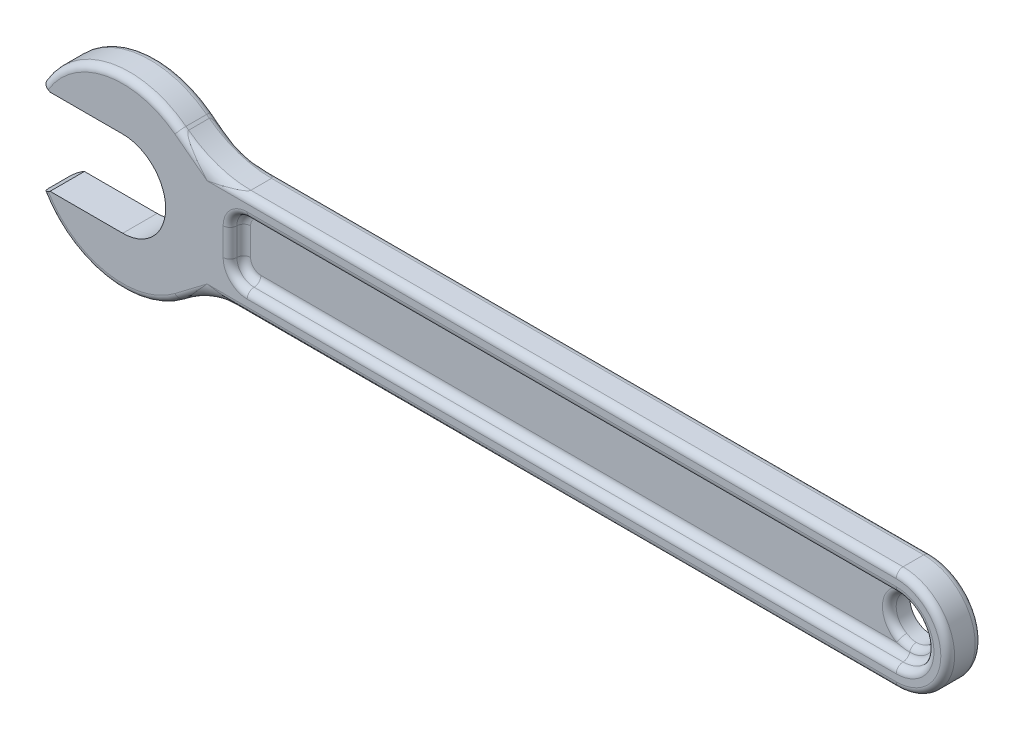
SolidWorks part; units mm, degrees
ref_plane "Front" through (0, 0, 0) normal (0, 0, 1) x (1, 0, 0)
ref_plane "Top" through (0, 0, 0) normal (0, 1, 0) x (1, 0, 0)
ref_plane "Right" through (0, 0, 0) normal (1, 0, 0) x (0, 0, -1)
sketch "Sketch1" plane through (0, 0, 0) normal (0, 0, 1) x (1, 0, 0)
  line L1 (-15.4891, 23.1705) -> (184.5109, 23.1705)
  line L2 (-15.4891, 23.1705) -> (-15.4891, -6.8295)
  line L3 (-15.4891, -6.8295) -> (184.5109, -6.8295)
  arc A0 (184.5109, -6.8295) -> (184.5109, 23.1705) centre (184.5109, 8.1705) ccw
  dimension "D1" = 30
  dimension "D2" = 200
extrude "Extrude1" add sketch "Sketch1" along normal blind 10
shell "Shell1" thickness 6
sketch "Sketch3" plane through (0, 0, 0) normal (0, 0, 1) x (1, 0, 0)
  line L0 (-15.4891, 23.1705) -> (-24.3001, 29.8482)
  line L1 (-15.4891, -6.8295) -> (-24.3001, -13.5072)
  line L2 (-15.4891, 23.1705) -> (-15.4891, -6.8295) construction
  line L3 (-15.4891, 23.1705) -> (-15.4891, -6.8295)
  arc A0 (-24.3001, 29.8482) -> (-24.3001, -13.5072) centre (-40.7293, 8.1705) ccw
  dimension "D1" = 54.4
extrude "Extrude2" add sketch "Sketch3" along normal through all
sketch "Sketch4" plane through (0, 0, 10) normal (0, 0, 1) x (1, 0, 0)
  line L0 (-40.7293, 20.6705) -> (-64.8869, 20.6705)
  line L1 (-40.7293, -4.3295) -> (-64.8869, -4.3295)
  arc A0 (-40.7293, -4.3295) -> (-40.7293, 20.6705) centre (-40.7293, 8.1705) ccw
  arc A1 (-24.3001, 29.8482) -> (-24.3001, -13.5072) centre (-40.7293, 8.1705) ccw construction
  arc A2 (-64.8869, 20.6705) -> (-64.8869, -4.3295) centre (-40.7293, 8.1705) ccw
  dimension "D1" = 25
extrude "Cut-Extrude1" cut sketch "Sketch4" against normal through all
sketch "Sketch5" plane through (0, 0, 6) normal (0, 0, 1) x (1, 0, 0)
  circle A0 centre (184.5109, 8.1705) radius 6
  dimension "D1" = 12
extrude "Cut-Extrude2" cut sketch "Sketch5" against normal through all
fillet "Fillet3" radius 5 2 edges at (-9.4891, -0.8295, 8) (-9.4891, 17.1705, 8)
fillet "Fillet1" radius 2 13 edges at (84.5109, -6.8295, 0) (199.5109, 8.1705, 0) (-19.8946, -10.1684, 0) (-19.8946, 26.5093, 0) (90.0109, 17.1705, 6) (193.5109, 8.1705, 6) (90.0109, -0.8295, 6) (-9.4891, 8.1705, 6) (84.5109, 23.1705, 0) (-46.7284, -18.3597, 0) (-46.7284, 34.7006, 0) (-8.0247, 15.706, 6) (-8.0247, 0.6349, 6)
fillet "Fillet4" radius 2 14 edges at (190.5109, 8.1705, 6) (-46.7284, 34.7006, 10) (84.5109, 23.1705, 10) (199.5109, 8.1705, 10) (-46.7284, -18.3597, 10) (-8.0247, 15.706, 10) (90.0109, 17.1705, 10) (193.5109, 8.1705, 10) (90.0109, -0.8295, 10) (-8.0247, 0.6349, 10) (-19.8946, 26.5093, 10) (84.5109, -6.8295, 10) (-19.8946, -10.1684, 10) (-9.4891, 8.1705, 10)
fillet "Fillet2" radius 30 6 edges at (-15.686, -6.2437, 0.5858) (-15.686, 22.5847, 0.5858) (-15.4891, -6.8295, 5) (-15.4891, 23.1705, 5) (-15.686, -6.2437, 9.4142) (-15.686, 22.5847, 9.4142)
chamfer "Chamfer1" distance 3 angle 30 2 edges at (-64.8869, 20.6705, 5) (-64.8869, -4.3295, 5)
